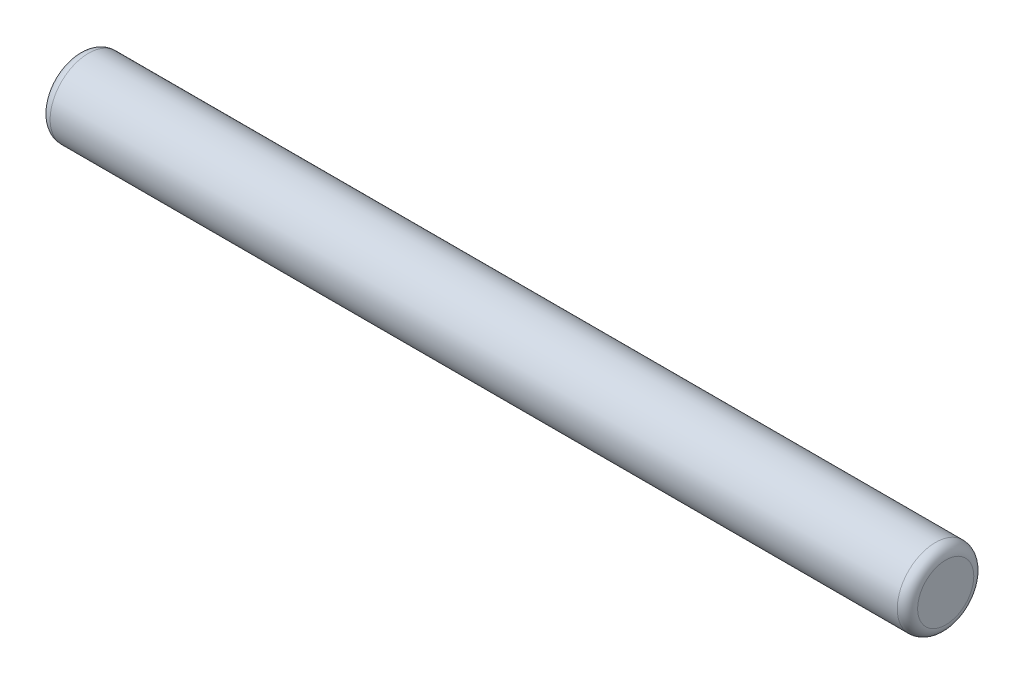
SolidWorks part; units mm, degrees
ref_plane "Front Plane" through (0, 0, 0) normal (0, 0, 1) x (1, 0, 0)
ref_plane "Top Plane" through (0, 0, 0) normal (0, 1, 0) x (1, 0, 0)
ref_plane "Right Plane" through (0, 0, 0) normal (1, 0, 0) x (0, 0, -1)
sketch "Sketch1" plane through (0, 0, 0) normal (1, 0, 0) x (0, 0, -1)
  circle A0 centre (0, 0) radius 4.7625
  dimension "D1" = 9.525
extrude "Boss-Extrude1" add sketch "Sketch1" along normal blind 107.95
fillet "Fillet1" radius 1.27 2 edges at (0, 0, -4.7625) (107.95, 0, -4.7625)
